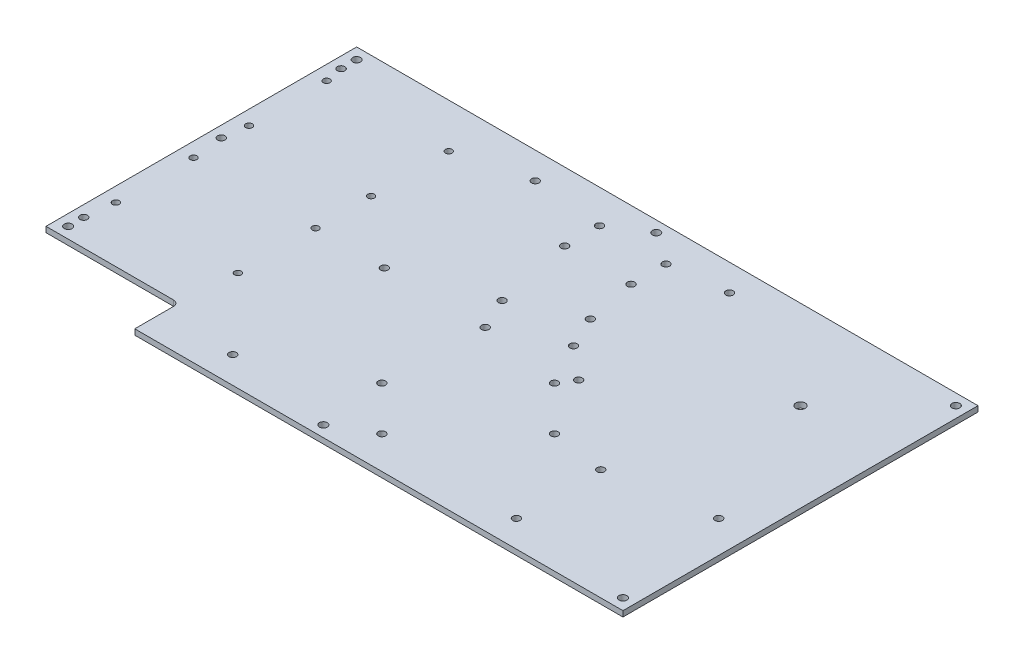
SolidWorks part; units mm, degrees
ref_plane "Front Plane" through (0, 0, 0) normal (0, 0, 1) x (1, 0, 0)
ref_plane "Top Plane" through (0, 0, 0) normal (0, 1, 0) x (1, 0, 0)
ref_plane "Right Plane" through (0, 0, 0) normal (1, 0, 0) x (0, 0, -1)
sketch "Sketch1" plane through (0, 0, 0) normal (0, 1, 0) x (1, 0, 0)
  line L1 (0, 0) -> (355.6, 0)
  line L2 (0, 0) -> (0, 203.2)
  line L3 (0, 203.2) -> (355.6, 203.2)
  line L4 (355.6, 0) -> (355.6, 203.2)
  dimension "D1" = 203.2
  dimension "D2" = 355.6
extrude "Boss-Extrude1" add sketch "Sketch1" along normal blind 3.175
hole_wizard "#8 Clearance Hole1" positions "Sketch2" profile "Sketch3" hole size "#8" standard "ANSI Inch"
sketch "Sketch2" plane through (0, 3.175, 0) normal (0, 1, 0) x (1, 0, 0)
  line L0 (6.35, 196.85) -> (349.25, 196.85) construction
  line L1 (349.25, 196.85) -> (349.25, 6.35) construction
  line L2 (349.25, 6.35) -> (6.35, 6.35) construction
  line L3 (6.35, 6.35) -> (6.35, 196.85) construction
  line L5 (0, 203.2) -> (0, 0) construction
  line L6 (355.6, 203.2) -> (0, 203.2) construction
  line L7 (355.6, 0) -> (355.6, 203.2) construction
  line L8 (0, 0) -> (355.6, 0) construction
  point P0 (6.35, 196.85)
  point P2 (177.8, 196.85)
  point P4 (349.25, 196.85)
  point P6 (349.25, 6.35)
  point P8 (177.8, 6.35)
  point P10 (6.35, 31.75)
  point P31 (0, 0)
  point P32 (6.35, 26.4842)
  dimension "D1" = 6.35
  dimension "D2" = 25.4
  dimension "D3" = 6.35
  dimension "D5" = 6.35
  dimension "D6" = 6.35
sketch "Sketch3" plane through (6.35, 3.175, -196.85) normal (1, 0, 0) x (0, 0, 1)
  line L0 (0, 0) -> (0, 3.175)
  line L1 (0, 3.175) -> (2.2479, 3.175)
  line L2 (2.2479, 3.175) -> (2.2479, 0)
  line L5 (2.2479, 0) -> (0, 0)
  line L11 (0, -6.35) -> (0, 107.95) construction
  dimension "Thru Hole Dia." = 4.4958
  dimension "Thru Hole Depth" = 3.175
hole_wizard "#6 Clearance Hole1" positions "Sketch4" profile "Sketch5" hole size "#6" standard "ANSI Inch"
sketch "Sketch4" plane through (0, 0, 0) normal (0, -1, 0) x (-1, 0, 0)
  point P0 (-8.2048, 57.1683)
  point P3 (-8.2048, 101.6183)
  point P6 (-78.0548, 101.6183)
  point P9 (-78.0548, 57.1683)
  point P12 (-8.2048, 133.3683)
  point P15 (-78.0548, 133.3683)
  point P18 (-78.0548, 177.8183)
  point P21 (-8.2048, 177.8183)
sketch "Sketch5" plane through (8.2048, 0, -57.1683) normal (1, 0, 0) x (0, 0, -1)
  line L0 (0, 0) -> (0, 3.175)
  line L1 (0, 3.175) -> (1.8986, 3.175)
  line L2 (1.8986, 3.175) -> (1.8986, 0)
  line L5 (1.8986, 0) -> (0, 0)
  line L11 (0, -6.35) -> (0, 107.95) construction
  dimension "Thru Hole Dia." = 3.7973
  dimension "Thru Hole Depth" = 3.175
hole_wizard "Hole for #2 300® SC Nuts (SP)1" positions "Sketch6" profile "Sketch7" hole size "#2-56" standard "PEM® Inch"
sketch "Sketch6" plane through (0, 3.175, 0) normal (0, 1, 0) x (1, 0, 0)
  point P0 (173.8246, 43.797)
  point P3 (223.216, 93.1885)
  point P6 (248.3607, 68.0437)
  point P9 (198.9693, 18.6523)
  point P13 (337.2691, 73.1366)
sketch "Sketch7" plane through (173.8246, 3.175, -43.797) normal (1, 0, 0) x (0, 0, 1)
  line L0 (0, 0) -> (0, 3.175)
  line L1 (0, 3.175) -> (2.1082, 3.175)
  line L2 (2.1082, 3.175) -> (2.1082, 0)
  line L5 (2.1082, 0) -> (0, 0)
  line L11 (0, -6.35) -> (0, 107.95) construction
  dimension "Thru Hole Dia." = 4.2164
  dimension "Thru Hole Depth" = 3.175
hole_wizard "Hole for #4 300® SC Nuts (SP)1" positions "Sketch8" profile "Sketch9" hole size "#4-40" standard "PEM® Inch"
sketch "Sketch8" plane through (0, 3.175, 0) normal (0, 1, 0) x (1, 0, 0)
  line L0 (6.35, 187.96) -> (228.6, 187.96) construction
  line L1 (228.6, 187.96) -> (228.6, 101.6) construction
  line L3 (6.35, 101.6) -> (228.6, 101.6) construction
  line L5 (6.35, 187.96) -> (6.35, 15.24) construction
  line L6 (6.35, 15.24) -> (279.4, 15.24) construction
  line L7 (279.4, 15.24) -> (279.4, 63.5) construction
  line L9 (355.6, 203.2) -> (0, 203.2) construction
  line L10 (0, 203.2) -> (0, 0) construction
  line L12 (0, 0) -> (355.6, 0) construction
  line L13 (117.475, 101.6) -> (117.0187, 15.24) construction
  point P0 (158.1449, 164.0628)
  point P3 (158.1177, 184.0628)
  point P6 (196.1177, 184.1144)
  point P9 (196.1449, 164.1144)
  point P12 (167.3023, 119.1088)
  point P15 (175.7792, 100.9941)
  point P18 (210.1971, 117.1003)
  point P21 (201.7201, 135.215)
  point P26 (6.35, 187.96)
  point P28 (6.35, 119.38)
  point P30 (6.35, 40.64)
  point P32 (117.0187, 15.24)
  point P34 (117.475, 101.6)
  point P36 (117.475, 187.96)
  point P38 (228.6, 187.96)
  point P40 (228.6, 101.6)
  point P42 (279.4, 63.5)
  point P44 (279.4, 15.24)
  point P72 (0, 0)
  point P73 (6.35, 32.1016)
  point P74 (0, 0)
  point P75 (6.35, 113.2126)
  dimension "D1" = 15.24
  dimension "D2" = 6.35
  dimension "D3" = 15.24
  dimension "D4" = 228.6
  dimension "D5" = 279.4
  dimension "D6" = 101.6
  dimension "D7" = 63.5
  dimension "D8" = 25.4
  dimension "D9" = 17.78
sketch "Sketch9" plane through (158.1449, 3.175, -164.0628) normal (1, 0, 0) x (0, 0, 1)
  line L0 (0, 0) -> (0, 3.175)
  line L1 (0, 3.175) -> (2.1082, 3.175)
  line L2 (2.1082, 3.175) -> (2.1082, 0)
  line L5 (2.1082, 0) -> (0, 0)
  line L11 (0, -6.35) -> (0, 107.95) construction
  dimension "Thru Hole Dia." = 4.2164
  dimension "Thru Hole Depth" = 3.175
hole_wizard "Hole for #8 300® SC Nuts (SP)1" positions "Sketch10" profile "Sketch11" hole size "#8-32" standard "PEM® Inch"
sketch "Sketch10" plane through (0, 3.175, 0) normal (0, 1, 0) x (1, 0, 0)
  line L2 (0, 203.2) -> (0, 0) construction
  line L3 (0, 0) -> (355.6, 0) construction
  point P0 (304.8, 152.4)
  dimension "D1" = 304.8
  dimension "D2" = 152.4
sketch "Sketch11" plane through (304.8, 3.175, -152.4) normal (1, 0, 0) x (0, 0, 1)
  line L0 (0, 0) -> (0, 3.175)
  line L1 (0, 3.175) -> (2.7051, 3.175)
  line L2 (2.7051, 3.175) -> (2.7051, 0)
  line L5 (2.7051, 0) -> (0, 0)
  line L11 (0, -6.35) -> (0, 107.95) construction
  dimension "Thru Hole Dia." = 5.4102
  dimension "Thru Hole Depth" = 3.175
sketch "Sketch12" plane through (0, 3.175, 0) normal (0, 1, 0) x (1, 0, 0)
  line L0 (0, 0) -> (355.6, 0) construction
  line L2 (-16.08, 25.4) -> (73.025, 25.4)
  line L4 (-16.08, 25.4) -> (-16.08, -15.2441)
  line L5 (-16.08, -15.2441) -> (76.2, -15.2441)
  line L6 (76.2, 22.225) -> (76.2, -15.2441)
  line L7 (0, 203.2) -> (0, 0) construction
  arc A0 (73.025, 25.4) -> (76.2, 22.225) centre (73.025, 22.225) cw
  dimension "D3" = 3.175
  dimension "D1" = 25.4
  dimension "D2" = 76.2
extrude "Cut-Extrude1" cut sketch "Sketch12" against normal through all
